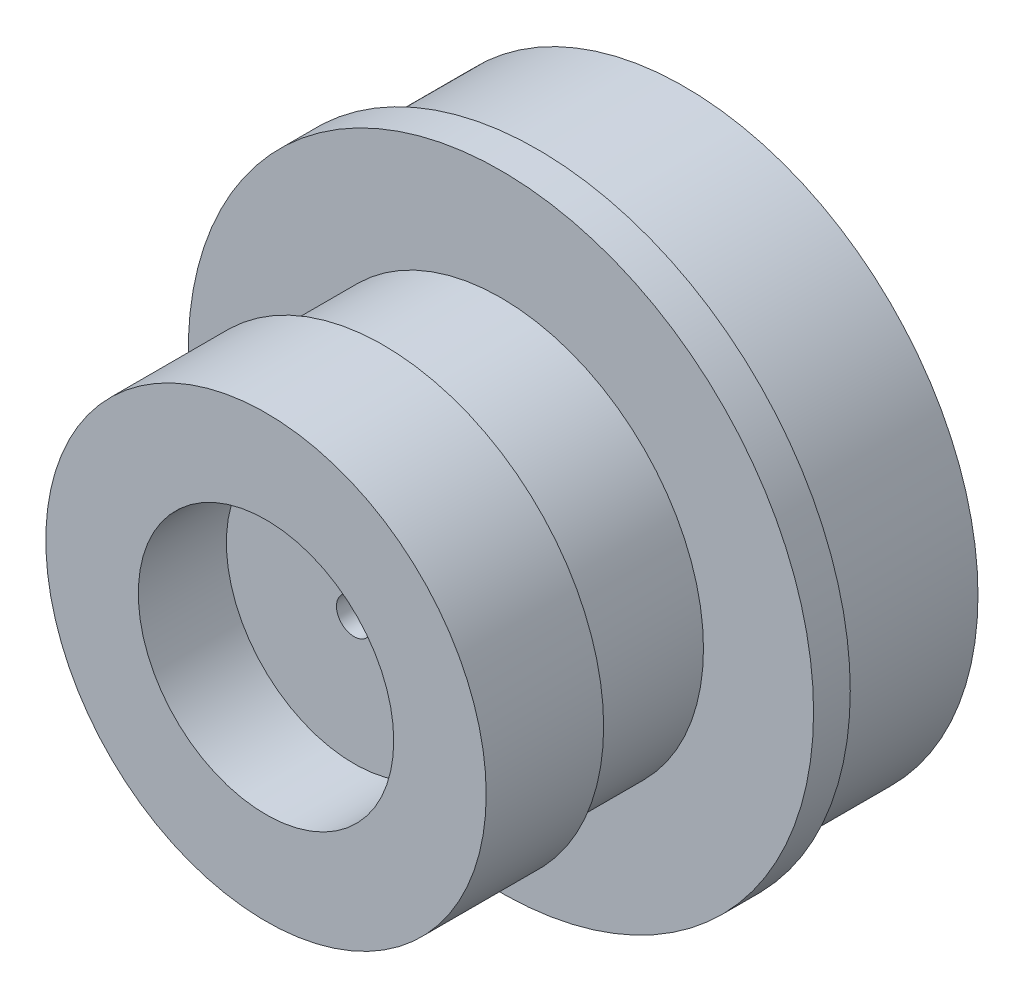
SolidWorks part; units mm, degrees
ref_plane "Front Plane" through (0, 0, 0) normal (0, 0, 1) x (1, 0, 0)
ref_plane "Top Plane" through (0, 0, 0) normal (0, 1, 0) x (1, 0, 0)
ref_plane "Right Plane" through (0, 0, 0) normal (1, 0, 0) x (0, 0, -1)
sketch "Sketch1" plane through (0, 0, 0) normal (0, 0, 1) x (1, 0, 0)
  circle A0 centre (0, 0) radius 25.4
  dimension "D1" = 50.8
extrude "Extrude1" add sketch "Sketch1" along normal blind 12.7
sketch "Sketch2" plane through (0, 0, 12.7) normal (0, 0, 1) x (1, 0, 0)
  circle A0 centre (0, 0) radius 27.051
  dimension "D1" = 54.102
extrude "Extrude2" add sketch "Sketch2" along normal blind 3.175
sketch "Sketch3" plane through (0, 0, 15.875) normal (0, 0, 1) x (1, 0, 0)
  circle A0 centre (0, 0) radius 17.526
extrude "Extrude3" add sketch "Sketch3" along normal blind 10.16
sketch "Sketch4" plane through (0, 0, 26.035) normal (0, 0, 1) x (1, 0, 0)
  circle A0 centre (0, 0) radius 19.05
extrude "Extrude4" add sketch "Sketch4" along normal blind 10.16
sketch "Sketch5" plane through (0, 0, 36.195) normal (0, 0, 1) x (1, 0, 0)
  circle A0 centre (0, 0) radius 11.049
extrude "Cut-Extrude1" cut sketch "Sketch5" against normal blind 7.62
sketch "Sketch6" plane through (0, 0, 28.575) normal (0, 0, 1) x (1, 0, 0)
  circle A0 centre (0, 0) radius 1.524
extrude "Cut-Extrude2" cut sketch "Sketch6" against normal through all
sketch "Sketch7" plane through (0, 0, 0) normal (0, 0, -1) x (-1, 0, 0)
  circle A0 centre (0, 0) radius 14.351
extrude "Cut-Extrude4" cut sketch "Sketch7" against normal blind 25.4
